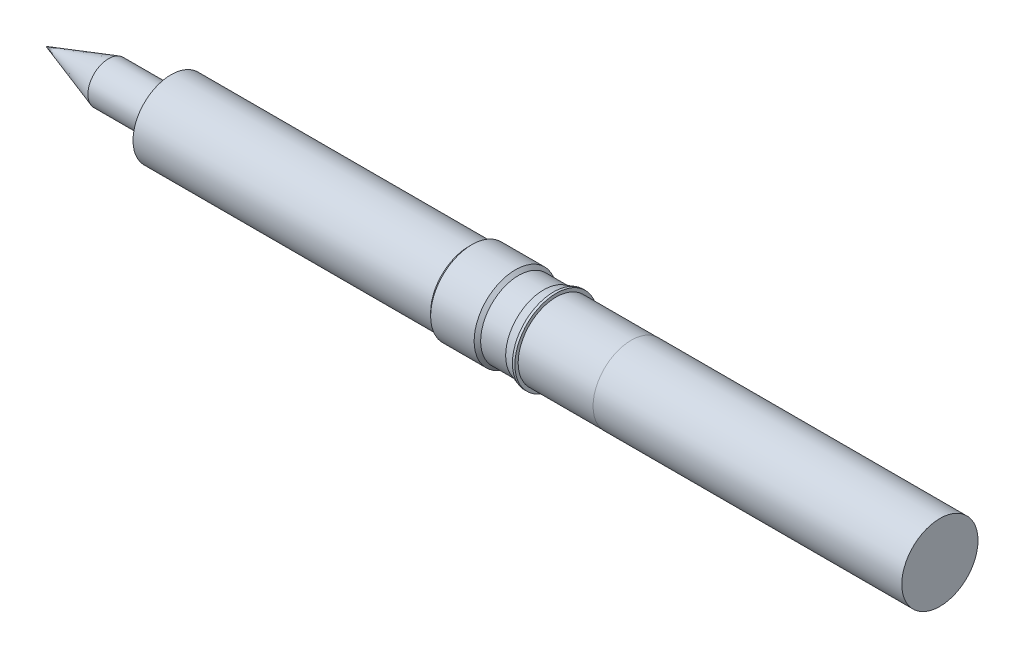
SolidWorks part; units mm, degrees
ref_plane "Front Plane" through (0, 0, 0) normal (0, 0, 1) x (1, 0, 0)
ref_plane "Top Plane" through (0, 0, 0) normal (0, 1, 0) x (1, 0, 0)
ref_plane "Right Plane" through (0, 0, 0) normal (1, 0, 0) x (0, 0, -1)
ref_plane "Plane1" through (0, 0, 0) normal (0, 0, -1) x (-1, 0, 0)
sketch "Sketch1" plane through (0, 0, 0) normal (0, 0, -1) x (-1, 0, 0)
  line L0 (-31.02, 1.524) -> (-31.02, 0)
  line L1 (-30.39, 0) -> (-5, 0)
  line L2 (-5, 0) -> (-5, 1.52)
  line L3 (-5, 1.52) -> (-16.9, 1.52)
  line L4 (-16.9, 1.52) -> (-17.03, 1.65)
  line L5 (-17.03, 1.65) -> (-18.77, 1.65)
  line L6 (-18.77, 1.65) -> (-18.9, 1.52)
  line L7 (-18.9, 1.52) -> (-19.9, 1.52)
  line L8 (-19.9, 1.52) -> (-20.3, 1.65)
  line L9 (-20.3, 1.65) -> (-20.4, 1.65)
  line L10 (-20.4, 1.65) -> (-20.4, 1.52)
  line L11 (-20.4, 1.52) -> (-23.4, 1.52)
  line L12 (-23.4, 1.52) -> (-23.4, 1.524)
  line L13 (-23.4, 1.524) -> (-31.02, 1.524)
  line L14 (-30.39, 0) -> (-5, 0) construction
  line L15 (-31.02, 0) -> (-30.39, 0)
revolve "Revolve1" add sketch "Sketch1" angle 360 about L14
sketch "Sketch4" plane through (5, 0, 0) normal (-1, 0, 0) x (0, 0, 1)
  circle A0 centre (0, 0) radius 0.825
extrude "Boss-Extrude2" add sketch "Sketch4" along normal blind 2.5
sketch "Sketch5" plane through (0, 0, 0) normal (0, 0, -1) x (-1, 0, 0)
  line L0 (-2.5, 0.825) -> (-2.5, 0)
  line L1 (-2.5, 0) -> (0, 0)
  line L2 (0, 0) -> (-2.5, 0.825)
  line L3 (-2.5, 0) -> (0.0001, 0) construction
revolve "Revolve2" add sketch "Sketch5" angle 360 about L3
sketch "Sketch7" plane through (31.02, 0, 0) normal (1, 0, 0) x (0, 0, -1)
  circle A0 centre (0, 0) radius 1.524
extrude "Boss-Extrude3" add sketch "Sketch7" along normal blind 4.7244
